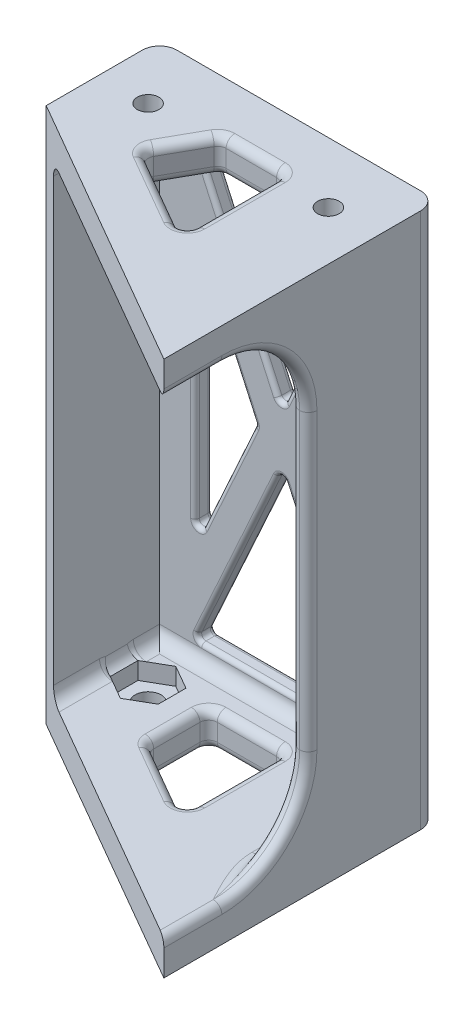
SolidWorks part; units mm, degrees
ref_plane "Front Plane" through (0, 0, 0) normal (0, 0, 1) x (1, 0, 0)
ref_plane "Top Plane" through (0, 0, 0) normal (0, 1, 0) x (1, 0, 0)
ref_plane "Right Plane" through (0, 0, 0) normal (1, 0, 0) x (0, 0, -1)
sketch "Sketch1" plane through (0, 0, 0) normal (0, 1, 0) x (1, 0, 0)
  line L1 (0, 0) -> (32.2, 0)
  line L2 (0, 0) -> (0, 34.25)
  line L3 (0, 34.25) -> (32.2, 34.25)
  line L4 (32.2, 0) -> (32.2, 34.25)
  dimension "D1" = 34.25
  dimension "D2" = 32.2
extrude "Boss-Extrude1" add sketch "Sketch1" along normal blind 4
sketch "Sketch2" plane through (0, 4, 0) normal (0, 1, 0) x (1, 0, 0)
  line L0 (32.2, 34.25) -> (0, 34.25) construction
  line L3 (16.1, 27.25) -> (5.67, 27.25) construction
  line L4 (16.1, 27.25) -> (26.53, 27.25) construction
  line L5 (16.1, 34.25) -> (16.1, 0) construction
  line L6 (0, 0) -> (32.2, 0) construction
  dimension "D1" = 10.43
  dimension "D2" = 7
ref_plane "Plane1" through (0, 58, 0) normal (0, 1, 0) x (1, 0, 0)
sketch "Sketch5" plane through (0, 58, 0) normal (0, 1, 0) x (1, 0, 0)
  line L1 (0, 34.25) -> (32.2, 34.25)
  line L2 (0, 34.25) -> (0, 0)
  line L3 (0, 0) -> (32.2, 0)
  line L4 (32.2, 34.25) -> (32.2, 0)
  dimension "D1" = 34.25
extrude "Boss-Extrude2" add sketch "Sketch5" along normal blind 4 separate body
sketch "Sketch6" plane through (0, 62, 0) normal (0, 1, 0) x (1, 0, 0)
  line L0 (16.1, 34.25) -> (16.1, 0) construction
  line L1 (32.2, 34.25) -> (0, 34.25) construction
  line L2 (0, 0) -> (32.2, 0) construction
  line L3 (16.1, 27.25) -> (5.67, 27.25) construction
  line L4 (16.1, 27.25) -> (26.53, 27.25) construction
  dimension "D1" = 10.43
  dimension "D2" = 7
sketch "Sketch11" plane through (0, 0, 0) normal (-1, 0, 0) x (0, 0, 1)
  line L0 (-34.25, 4) -> (-34.25, 58)
  line L1 (-34.25, 58) -> (0, 58)
  line L2 (0, 58) -> (0, 4)
  line L3 (0, 4) -> (-34.25, 4)
  line L4 (-34.25, 31) -> (0, 31) construction
extrude "Boss-Extrude3" add sketch "Sketch11" against normal blind 2
sketch "Sketch24" plane through (0, 0, 0) normal (0, -1, 0) x (1, 0, 0)
  line L0 (16.1, -34.25) -> (16.1, 71.9) construction
  line L1 (108.0286, 41.2361) -> (-3.3086, -23.0444)
  line L2 (108.0286, 18.825) -> (108.0286, 124.975) construction
  line L3 (108.0286, 124.975) -> (16.1, 178.05) construction
  line L4 (16.1, 178.05) -> (-75.8286, 124.975) construction
  line L5 (-75.8286, 124.975) -> (-75.8286, 18.825) construction
  line L6 (-75.8286, 18.825) -> (16.1, -34.25) construction
  line L7 (16.1, -34.25) -> (108.0286, 18.825) construction
  line L8 (-3.3086, -23.0444) -> (-39.5686, 39.7597)
  line L9 (108.0286, 41.2361) -> (71.7686, 104.0403)
  line L10 (-39.5686, 39.7597) -> (71.7686, 104.0403)
  circle A0 centre (16.1, 71.9) radius 91.9286 construction
  dimension "D1" = 106.15
  dimension "D2" = 72.52
extrude "Cut-Extrude6" cut sketch "Sketch24" against normal through all
sketch "Sketch26" plane through (32.2, 0, 0) normal (1, 0, 0) x (0, 0, -1)
  line L0 (34.25, 4) -> (34.25, 58)
  line L1 (34.25, 58) -> (2.5435, 58)
  line L2 (2.5435, 58) -> (2.5435, 4)
  line L3 (2.5435, 4) -> (34.25, 4)
extrude "Boss-Extrude5" add sketch "Sketch26" against normal blind 2
sketch "Sketch27" plane through (0, 58, 0) normal (0, 1, 0) x (1, 0, 0)
  line L3 (32.2, 2.5435) -> (30.2, 3.6982)
  line L4 (30.2, 3.6982) -> (30.2, 2.5435)
  line L5 (30.2, 2.5435) -> (32.2, 2.5435)
  line L6 (32.2, 2.5435) -> (30.2, 3.6982)
  line L7 (30.2, 3.6982) -> (30.2, 2.5435)
  line L8 (30.2, 2.5435) -> (32.2, 2.5435)
  dimension "D1" = 0
extrude "Cut-Extrude7" cut sketch "Sketch27" against normal through all
sketch "Sketch28" plane through (32.2, 0, 0) normal (1, 0, 0) x (0, 0, -1)
  line L3 (2.5435, 62) -> (2.5435, 0) construction
  line L7 (19.25, 4) -> (19.25, 58)
  line L8 (19.25, 58) -> (2.5435, 58)
  line L9 (2.5435, 62) -> (34.25, 62) construction
  line L10 (34.25, 0) -> (34.25, 62) construction
  line L11 (2.5435, 0) -> (34.25, 0) construction
  line L12 (19.25, 4) -> (2.5435, 4)
  line L13 (2.5435, 4) -> (2.5435, 58)
  dimension "D1" = 4
  dimension "D4" = 4
  dimension "D6" = 15
extrude "Cut-Extrude8" cut sketch "Sketch28" against normal up to next
sketch "Sketch29" plane through (0, 62, 0) normal (0, 1, 0) x (1, 0, 0)
  line L0 (20.53, 16.2094) -> (9.824, 22.3905)
  line L1 (9.824, 22.3905) -> (13.1097, 28.25)
  line L2 (13.1097, 28.25) -> (20.53, 28.25)
  line L3 (20.53, 28.25) -> (20.53, 16.2094)
  line L4 (32.2, 2.5435) -> (0, 21.1342) construction
  line L5 (32.2, 34.25) -> (0, 34.25) construction
  dimension "D1" = 6
  dimension "D2" = 6
  dimension "D3" = 6
  dimension "D4" = 6
extrude "Cut-Extrude9" cut sketch "Sketch29" against normal up to next
sketch "Sketch30" plane through (0, 4, 0) normal (0, 1, 0) x (1, 0, 0)
  line L0 (20.53, 28.25) -> (20.53, 16.2094)
  line L1 (20.53, 16.2094) -> (11.67, 21.3247)
  line L2 (11.67, 21.3247) -> (11.67, 28.25)
  line L3 (20.53, 28.25) -> (11.67, 28.25)
  line L4 (2, 19.9795) -> (32.2, 2.5435) construction
  line L5 (30.2, 34.25) -> (2, 34.25) construction
  dimension "D1" = 6
  dimension "D2" = 6
  dimension "D3" = 6
  dimension "D4" = 6
extrude "Cut-Extrude10" cut sketch "Sketch30" against normal up to next
fillet "Fillet1" radius 1 24 edges at (16.8199, 58, -28.25) (16.8199, 62, -28.25) (15.177, 62, -19.3) (15.177, 58, -19.3) (11.4669, 62, -25.3203) (11.4669, 58, -25.3203) (20.53, 62, -22.2297) (20.53, 58, -22.2297) (11.67, 0, -24.7874) (11.67, 4, -24.7874) (16.1, 0, -28.25) (16.1, 4, -28.25) (16.1, 0, -18.7671) (16.1, 4, -18.7671) (20.53, 0, -22.2297) (20.53, 4, -22.2297) (11.67, 2, -28.25) (11.67, 2, -21.3247) (20.53, 2, -28.25) (20.53, 2, -16.2094) (9.824, 60, -22.3905) (13.1097, 60, -28.25) (20.53, 60, -28.25) (20.53, 60, -16.2094)
fillet "Fillet2" radius 2 2 edges at (32.2, 31, -34.25) (0, 31, -34.25)
sketch "Sketch31" plane through (2, 0, 0) normal (1, 0, 0) x (0, 0, -1)
  line L0 (34.25, 4) -> (34.25, 58)
  line L1 (34.25, 58) -> (32.25, 58)
  line L2 (19.9795, 58) -> (34.25, 58) construction
  line L3 (32.25, 58) -> (32.25, 4)
  line L4 (34.25, 4) -> (19.9795, 4) construction
  line L5 (32.25, 4) -> (34.25, 4)
  dimension "D1" = 2
extrude "Boss-Extrude6" add sketch "Sketch31" along normal up to next
sketch "Sketch32" plane through (0, 0, -34.25) normal (0, 0, -1) x (-1, 0, 0)
  line L0 (-16.1, 62) -> (-16.1, 0) construction
  line L1 (-30.2, 62) -> (-2, 62) construction
  line L2 (-30.2, 0) -> (-2, 0) construction
  line L3 (-32.2, 31) -> (0, 31) construction
  line L4 (-32.2, 0) -> (-32.2, 62) construction
  line L5 (0, 62) -> (0, 0) construction
  line L6 (-6.0935, 56) -> (-26.1065, 56)
  line L7 (-26.1065, 56) -> (-16.1, 34)
  line L9 (-30.2, 62) -> (-2, 0) construction
  line L10 (-6.0935, 56) -> (-16.1, 34)
  line L11 (-6.0935, 6) -> (-16.1, 28)
  line L12 (-6.0935, 6) -> (-26.1065, 6)
  line L13 (-26.1065, 6) -> (-16.1, 28)
  line L14 (-6.0935, 46.4043) -> (-6.0935, 15.5957)
  line L15 (-6.0935, 46.4043) -> (-13.1, 31)
  line L17 (-6.0935, 15.5957) -> (-13.1, 31)
  line L18 (-26.1065, 46.4043) -> (-26.1065, 15.5957)
  line L19 (-26.1065, 46.4043) -> (-19.1, 31)
  line L20 (-26.1065, 15.5957) -> (-19.1, 31)
  point P14 (-16.1, 31)
  point P29 (-6.0935, 31)
  dimension "D1" = 6
  dimension "D2" = 3
  dimension "D3" = 3
extrude "Cut-Extrude11" cut sketch "Sketch32" against normal up to next
fillet "Fillet3" radius 0.5 36 edges at (9.5968, 38.7021, -32.25) (9.5968, 38.7021, -34.25) (9.5968, 23.2979, -34.25) (9.5968, 23.2979, -32.25) (22.6032, 23.2979, -32.25) (22.6032, 23.2979, -34.25) (22.6032, 38.7021, -34.25) (22.6032, 38.7021, -32.25) (21.1032, 45, -32.25) (21.1032, 45, -34.25) (11.0968, 45, -34.25) (11.0968, 45, -32.25) (11.0968, 17, -32.25) (11.0968, 17, -34.25) (21.1032, 17, -34.25) (21.1032, 17, -32.25) (6.0935, 46.4043, -33.25) (6.0935, 31, -34.25) (6.0935, 15.5957, -33.25) (6.0935, 31, -32.25) (26.1065, 15.5957, -33.25) (26.1065, 31, -34.25) (26.1065, 46.4043, -33.25) (26.1065, 31, -32.25) (26.1065, 56, -33.25) (16.1, 56, -34.25) (6.0935, 56, -33.25) (16.1, 56, -32.25) (6.0935, 6, -33.25) (16.1, 6, -34.25) (26.1065, 6, -33.25) (16.1, 6, -32.25) (19.1, 31, -33.25) (13.1, 31, -33.25) (16.1, 34, -33.25) (16.1, 28, -33.25)
fillet "Fillet4" radius 10 2 edges at (31.2, 58, -19.25) (31.2, 4, -19.25)
fillet "Fillet5" radius 1 8 edges at (32.2, 58, -5.8968) (32.2, 55.0711, -16.3211) (32.2, 31, -19.25) (32.2, 6.9289, -16.3211) (32.2, 4, -5.8968) (30.2, 55.0711, -16.3211) (30.2, 31, -19.25) (30.2, 6.9289, -16.3211)
sketch "Sketch35" plane through (0, 4, 0) normal (0, 1, 0) x (1, 0, 0)
  line L0 (30.2, 13.8326) -> (30.2, 32.25) construction
  line L1 (8.445, 28.8521) -> (5.67, 30.4543)
  line L2 (5.67, 30.4543) -> (2.895, 28.8521)
  line L3 (2.895, 28.8521) -> (2.895, 25.6479)
  line L4 (2.895, 25.6479) -> (5.67, 24.0457)
  line L5 (5.67, 24.0457) -> (8.445, 25.6479)
  line L6 (8.445, 25.6479) -> (8.445, 28.8521)
  line L7 (23.755, 25.6479) -> (26.53, 24.0457)
  line L8 (26.53, 24.0457) -> (29.305, 25.6479)
  line L9 (29.305, 25.6479) -> (29.305, 28.8521)
  line L10 (29.305, 28.8521) -> (26.53, 30.4543)
  line L11 (26.53, 30.4543) -> (23.755, 28.8521)
  line L12 (23.755, 28.8521) -> (23.755, 25.6479)
  line L13 (2, 32.25) -> (2, 19.9795) construction
  circle A0 centre (5.67, 27.25) radius 2.775 construction
  circle A1 centre (26.53, 27.25) radius 2.775 construction
  dimension "D1" = 5.55
extrude "Cut-Extrude14" cut sketch "Sketch35" against normal blind 2
fillet "Fillet6" radius 1.5 8 edges at (30.4594, 58, -11.8326) (30.4594, 4, -11.8326) (2, 58, -26.1148) (16.1, 58, -32.25) (30.2, 58, -23.0413) (30.2, 4, -23.0413) (16.1, 4, -32.25) (2, 4, -26.1148)
sketch "Sketch37" plane through (0, 4, 0) normal (0, 1, 0) x (1, 0, 0)
  circle A0 centre (5.67, 27.25) radius 1.5
  circle A1 centre (26.53, 27.25) radius 1.5
  dimension "D1" = 3
extrude "Cut-Extrude15" cut sketch "Sketch37" against normal blind 10
sketch "Sketch38" plane through (0, 62, 0) normal (0, 1, 0) x (1, 0, 0)
  circle A0 centre (5.67, 27.25) radius 1.25
  circle A1 centre (26.53, 27.25) radius 1.25
  dimension "D1" = 2.5
extrude "Cut-Extrude16" cut sketch "Sketch38" against normal up to next
